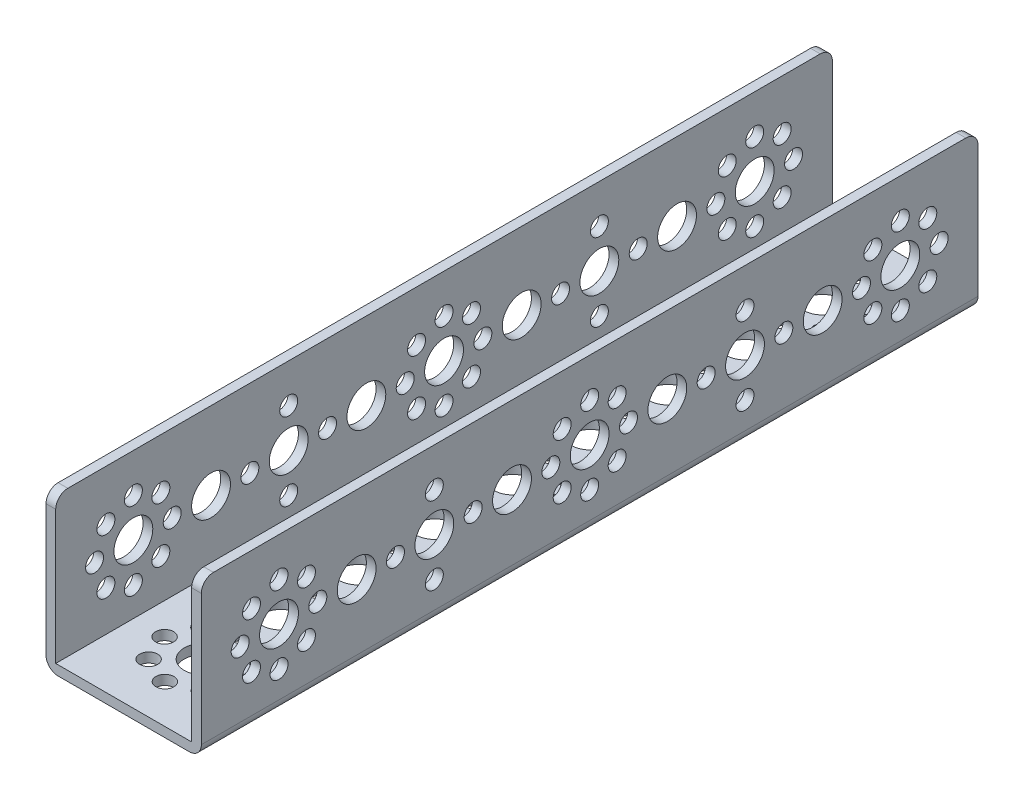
SolidWorks part; units mm, degrees
ref_plane "Front Plane" through (0, 0, 0) normal (0, 0, 1) x (1, 0, 0)
ref_plane "Top Plane" through (0, 0, 0) normal (0, 1, 0) x (1, 0, 0)
ref_plane "Right Plane" through (0, 0, 0) normal (1, 0, 0) x (0, 0, -1)
sketch "Sketch1" plane through (0, 0, 0) normal (0, 0, 1) x (1, 0, 0)
  line L0 (2.5, 0) -> (29.5, 0)
  line L1 (32, 2.5) -> (32, 32)
  line L2 (32, 32) -> (30, 32)
  line L3 (30, 32) -> (30, 2)
  line L4 (30, 2) -> (2, 2)
  line L5 (2, 2) -> (2, 32)
  line L6 (2, 32) -> (0, 32)
  line L7 (0, 32) -> (0, 2.5)
  arc A0 (0, 2.5) -> (2.5, 0) centre (2.5, 2.5) ccw
  arc A1 (32, 2.5) -> (29.5, 0) centre (29.5, 2.5) cw
  point P11 (0, 0)
  point P14 (32, 0)
  dimension "D6" = 2.5
  dimension "D1" = 32
  dimension "D2" = 2
  dimension "D3" = 2
  dimension "D4" = 32
  dimension "D5" = 2
extrude "Extrude1" add sketch "Sketch1" against normal blind 160
sketch "Sketch2"
sketch_block_instance "Block6-1"
sketch_block "Block6" parameters "D1"=16, "D2"=16, "D3"=16, "D4"=16, "D5"=16, "D6"=16, "D7"=16, "D8"=16
sketch_block_instance "Block5-1"
sketch_block "Block5"
sketch_block_instance "Block2-4"
sketch_block "Block2"
sketch_block_instance "Block5-2"
sketch_block_instance "Block2-6"
sketch_block_instance "Block2-5"
extrude "Cut-Extrude1" cut sketch "Sketch2" against normal through all
sketch "Sketch5" plane through (0, 0, 0) normal (0, -1, 0) x (1, 0, 0)
  line L0 (2.5, 0) -> (29.5, 0) construction
  line L2 (0, -160) -> (0, 0) construction
  dimension "D1" = 16
  dimension "D2" = 16
sketch_block_instance "Block6-3"
extrude "Cut-Extrude2" cut sketch "Sketch5" against normal up to surface (2 mm away)
fillet "Fillet1" radius 2.5 1 edges at (31, 32, 0)
fillet "Fillet2" radius 2.5 1 edges at (1, 32, 0)
fillet "Fillet3" radius 2.5 1 edges at (1, 32, -160)
fillet "Fillet4" radius 2.5 1 edges at (31, 32, -160)
